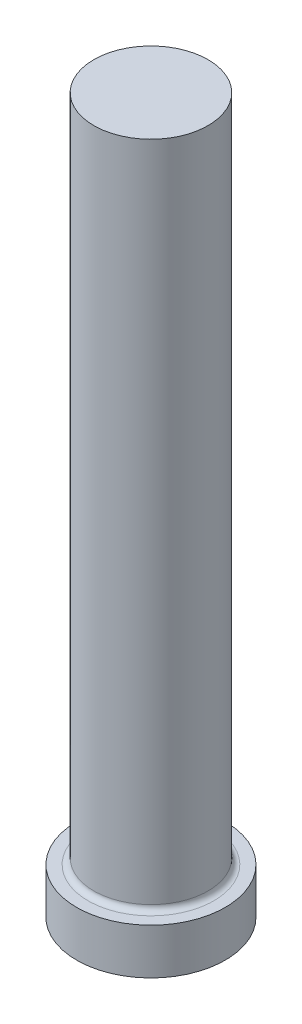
SolidWorks part; units mm, degrees
ref_plane "Plano frontal" through (0, 0, 0) normal (0, 0, 1) x (1, 0, 0)
ref_plane "Plano superior" through (0, 0, 0) normal (0, 1, 0) x (1, 0, 0)
ref_plane "Plano direito" through (0, 0, 0) normal (1, 0, 0) x (0, 0, -1)
sketch "Esboço1" plane through (0, 0, 0) normal (0, 0, 1) x (1, 0, 0)
  line L0 (0, 0) -> (13, 0)
  line L1 (13, 0) -> (13, 8)
  line L2 (13, 8) -> (11, 8)
  line L3 (10, 9) -> (10, 125)
  line L4 (10, 125) -> (0, 125)
  line L5 (0, 125) -> (0, 0) construction
  line L6 (0, 0) -> (0, 125)
  arc A0 (11, 8) -> (10, 9) centre (11, 9) cw
  dimension "D3" = 1
  dimension "D1" = 26
  dimension "D2" = 20
  dimension "D4" = 8
  dimension "D5" = 125
revolve "Revolução1" add sketch "Esboço1" angle 360 about L5
sketch "Esboço2"
  dimension "D1" = 0.975
  dimension "D2" = 2.275
  dimension "D3" = 1.4625
  dimension "D4" = 6.9875
wrap "Envolver1" sketch "Esboço2" source sketch "Esboço2" thickness 0.1 parameters "D1"=0.1
